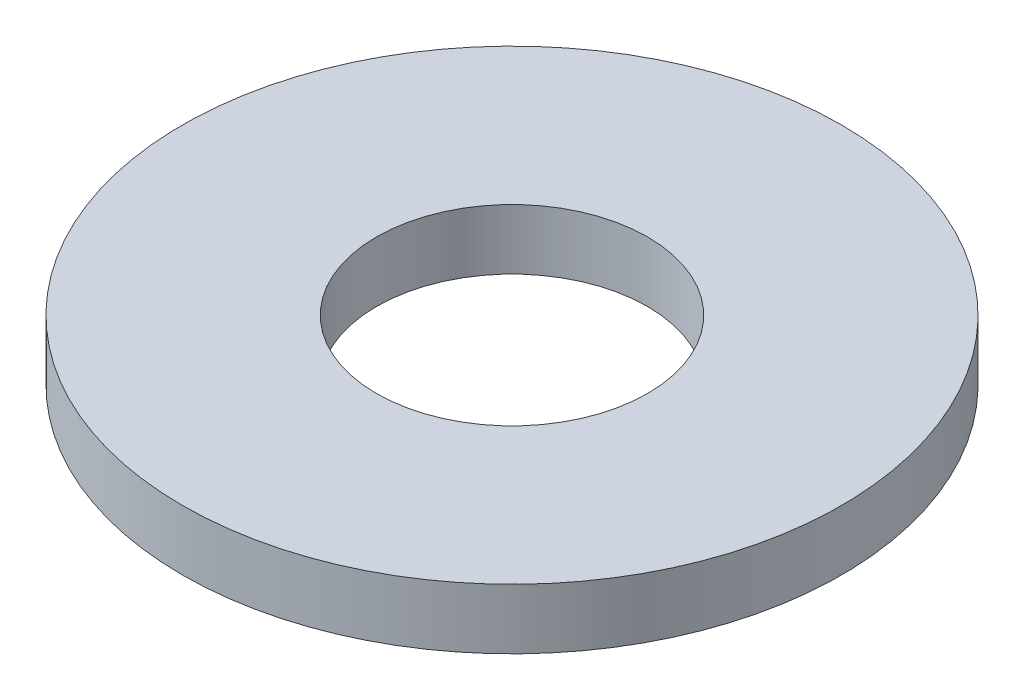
SolidWorks part; units mm, degrees
ref_plane "Front" through (0, 0, 0) normal (0, 0, 1) x (1, 0, 0)
ref_plane "Top" through (0, 0, 0) normal (0, 1, 0) x (1, 0, 0)
ref_plane "Right" through (0, 0, 0) normal (1, 0, 0) x (0, 0, -1)
sketch "Sketch1" plane through (0, 0, 0) normal (0, 1, 0) x (1, 0, 0)
  circle A0 centre (0, 0) radius 2.286
  circle A1 centre (0, 0) radius 5.5562
  dimension "D1" = 4.572
  dimension "D2" = 11.1125
extrude "Boss-Extrude1" add sketch "Sketch1" along normal blind 1.016
